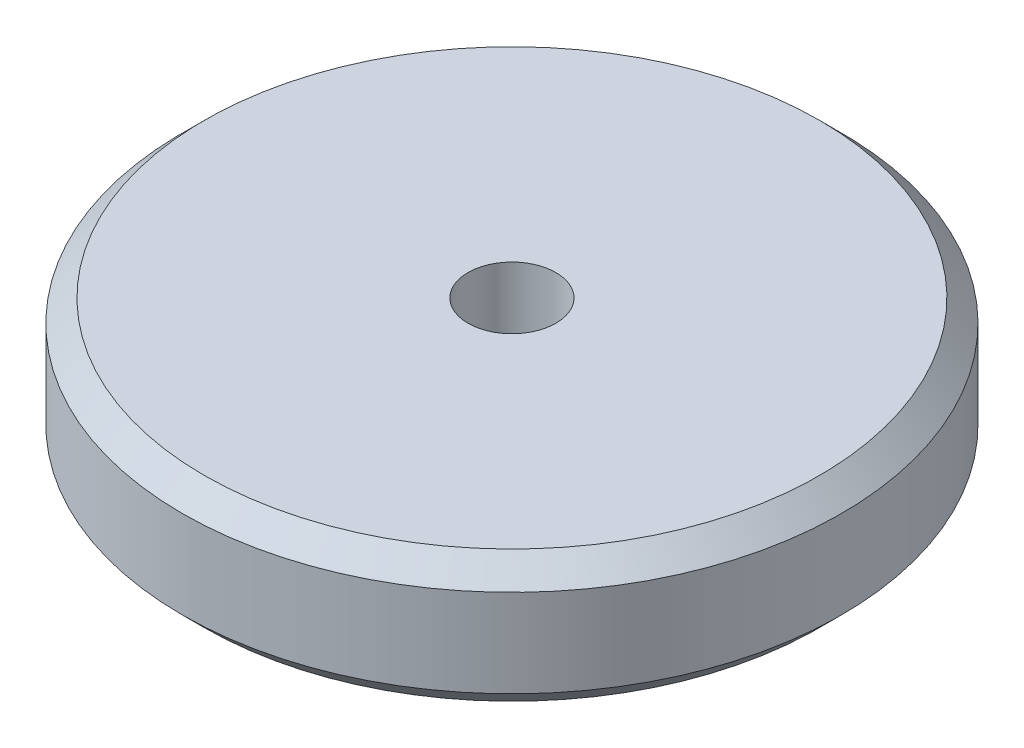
SolidWorks part; units mm, degrees
ref_plane "Front" through (0, 0, 0) normal (0, 0, 1) x (1, 0, 0)
ref_plane "Top" through (0, 0, 0) normal (0, 1, 0) x (1, 0, 0)
ref_plane "Right" through (0, 0, 0) normal (1, 0, 0) x (0, 0, -1)
sketch "Sketch1" plane through (0, 0, 0) normal (0, 1, 0) x (1, 0, 0)
  circle A0 centre (0, 0) radius 15
  circle A1 centre (0, 0) radius 2
extrude "Extrude1" add sketch "Sketch1" along normal blind 6
chamfer "Chamfer1" distance 1 angle 45 2 edges at (0, 0, 15) (0, 6, 15)
